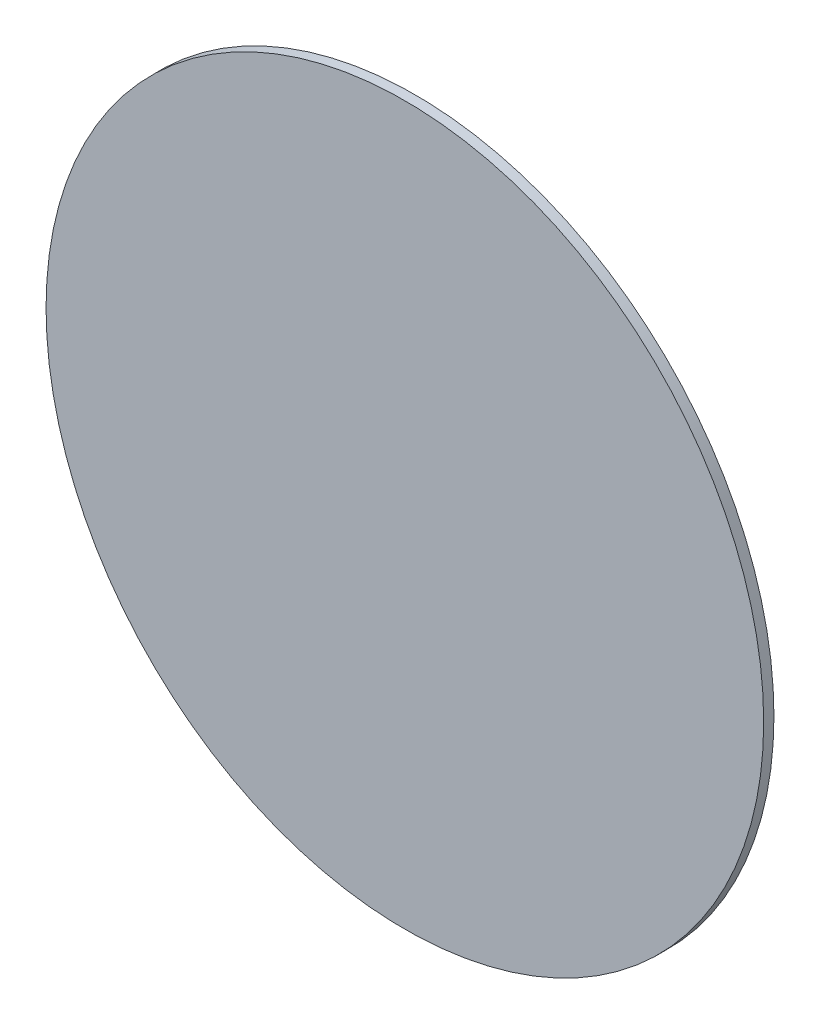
SolidWorks part; units mm, degrees
ref_plane "Plan de face" through (0, 0, 0) normal (0, 0, 1) x (1, 0, 0)
ref_plane "Plan de dessus" through (0, 0, 0) normal (0, 1, 0) x (1, 0, 0)
ref_plane "Plan de droite" through (0, 0, 0) normal (1, 0, 0) x (0, 0, -1)
sketch "Esquisse1" plane through (0, 0, 0) normal (0, 0, 1) x (1, 0, 0)
  circle A0 centre (0, 0) radius 17.5
  dimension "D1" = 35
extrude "Boss.-Extru.1" add sketch "Esquisse1" along normal blind 0.5
